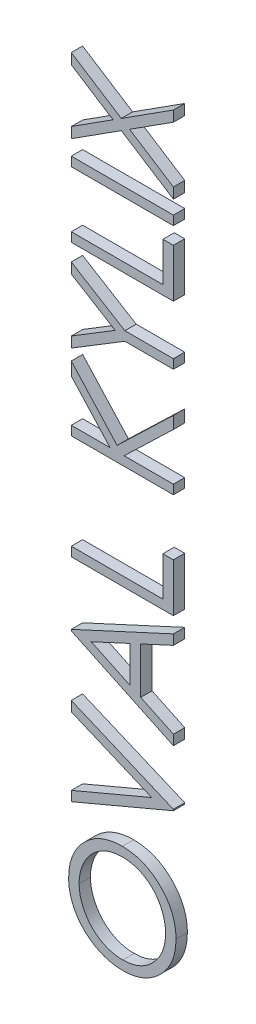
SolidWorks part; units mm, degrees
ref_plane "Piano frontale" through (0, 0, 0) normal (0, 0, 1) x (1, 0, 0)
ref_plane "Piano superiore" through (0, 0, 0) normal (0, 1, 0) x (1, 0, 0)
ref_plane "Piano destro" through (0, 0, 0) normal (1, 0, 0) x (0, 0, -1)
sketch "Schizzo2" plane through (0, 0, 0) normal (0, 0, 1) x (1, 0, 0)
  line L1 (195, 0) -> (195, 1000) construction
  text T0 "OVAL KYLIX" font "Century Gothic" height 90
extrude "Estrusione-Estrusione1" add sketch "Schizzo2" along normal blind 10
